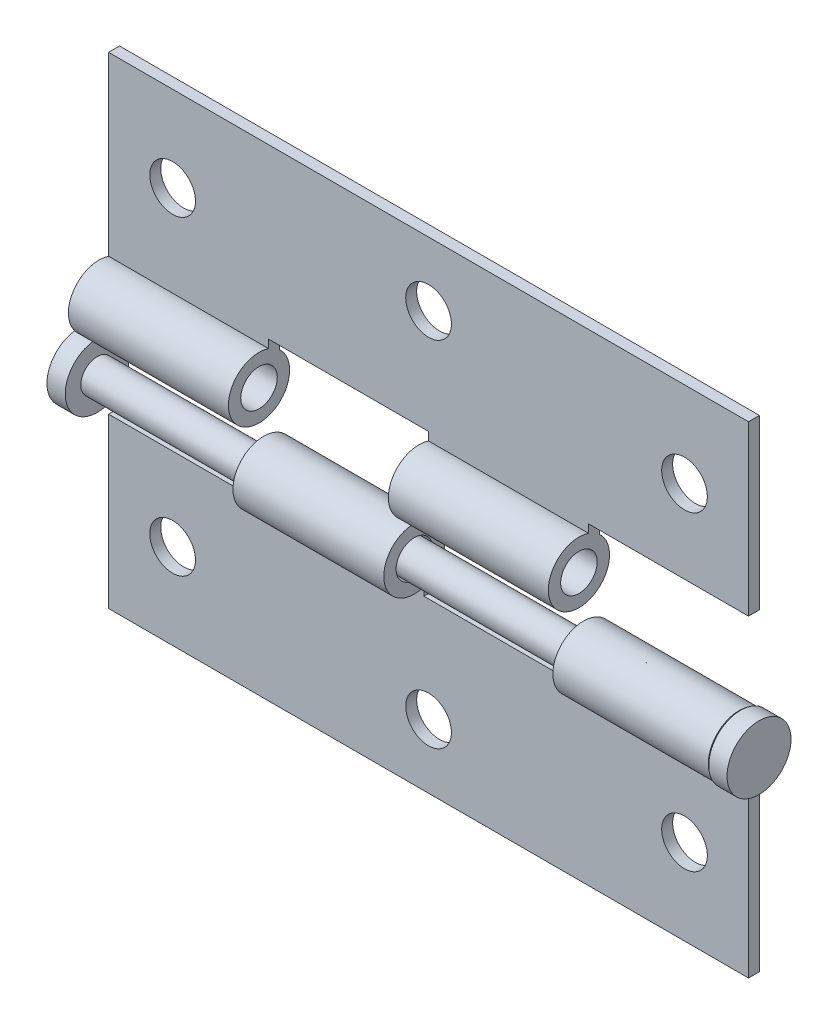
SolidWorks part; units mm, degrees
ref_plane "Front Plane" through (0, 0, 0) normal (0, 0, 1) x (1, 0, 0)
ref_plane "Top Plane" through (0, 0, 0) normal (0, 1, 0) x (1, 0, 0)
ref_plane "Right Plane" through (0, 0, 0) normal (1, 0, 0) x (0, 0, -1)
sketch "Sketch1" plane through (0, 0, 0) normal (1, 0, 0) x (0, 0, -1)
  line L0 (-2.25, -3.85) -> (-2.25, -0.5) construction
  line L2 (-1.2, -7.0312) -> (-1.2, -26.35)
  line L3 (-1.2, -26.35) -> (0, -26.35)
  line L4 (0, -6.3319) -> (0, -26.35)
  arc A0 (0, -6.3319) -> (-1.2, -7.0312) centre (-2.25, -3.85) ccw
  circle A1 centre (-2.25, -3.85) radius 2
  dimension "D2" = 6.7
  dimension "D5" = 4
  dimension "D1" = 1.2
  dimension "D3" = 25.85
  dimension "D4" = 2.25
  dimension "D6" = 0.5
extrude "Boss-Extrude1" add sketch "Sketch1" along normal mid plane 70
sketch "Sketch2" plane through (35, 0, 0) normal (1, 0, 0) x (0, 0, -1)
  circle A2 centre (-2.25, -3.85) radius 1.8
  circle A3 centre (-2.25, -3.85) radius 1.8
  dimension "D1" = 0.2
extrude "Boss-Extrude2" add sketch "Sketch2" against normal offset from surface (70.4 mm away) 0.2 from offset 0.2 separate body
sketch "Sketch3" plane through (35.2, 0, 0) normal (1, 0, 0) x (0, 0, -1)
  circle A0 centre (-2.25, -3.85) radius 3.5
  circle A1 centre (-2.25, -3.85) radius 1.8 construction
  dimension "D1" = 7
extrude "Boss-Extrude3" add sketch "Sketch3" along normal blind 2
mirror "Mirror1" about plane through (0, 0, 0) normal (1, 0, 0) of "Boss-Extrude3"
mirror "Mirror2" about plane through (0, 0, 0) normal (0, 1, 0)
sketch "Sketch4" plane through (0, 0, 0) normal (0, 0, 1) x (1, 0, 0)
  line L0 (35, -0.5) -> (-35, -0.5) construction
  line L1 (-0.5, -0.5) -> (18, -0.5)
  line L2 (-0.5, -0.5) -> (-0.5, -7.9312)
  line L3 (-0.5, -7.9312) -> (18, -7.9312)
  line L4 (18, -0.5) -> (18, -7.9312)
  line L6 (35, 7.0312) -> (35, 26.35) construction
  line L7 (35, 7.9312) -> (17.5, 7.9312)
  line L8 (35, 7.9312) -> (35, 0.5)
  line L9 (35, 0.5) -> (17.5, 0.5)
  line L10 (17.5, 7.9312) -> (17.5, 0.5)
  line L11 (-35, 0.5) -> (35, 0.5) construction
  line L13 (35, -7.0312) -> (-35, -7.0312) construction
extrude "Cut-Extrude1" cut sketch "Sketch4" against normal through all both and the other way through all
pattern_linear "LPattern1" count 2 spacing 35 along (-1, 0, 0) of "Cut-Extrude1"
sketch "Sketch5" plane through (0, 0, 1.2) normal (0, 0, 1) x (1, 0, 0)
  line L0 (0, -3.85) -> (0, 3.85) construction
  line L1 (3.85, 0) -> (-3.85, 0) construction
  line L2 (35, -7.0312) -> (35, -26.35) construction
  line L3 (35, -26.35) -> (-35, -26.35) construction
  circle A0 centre (-28, -17) radius 2.5
  circle A1 centre (28, -17) radius 2.5
  circle A2 centre (0, -19.35) radius 2.5
  circle A3 centre (0, 19.35) radius 2.5
  circle A4 centre (28, 17) radius 2.5
  circle A5 centre (-28, 17) radius 2.5
  dimension "D1" = 7
  dimension "D3" = 5
  dimension "D2" = 9.35
  dimension "D4" = 2.35
extrude "Cut-Extrude2" cut sketch "Sketch5" against normal through all
other "Save Bodies1"
equation "\"D1@Boss-Extrude2\" = \"D19@Boss-Extrude2\""
equation "\"D4@Sketch4\" = \"D2@Sketch4\" + \"D1@Sketch4\" * 2"
equation "\"D3@LPattern1\" = \"D2@Sketch4\" * 2"
